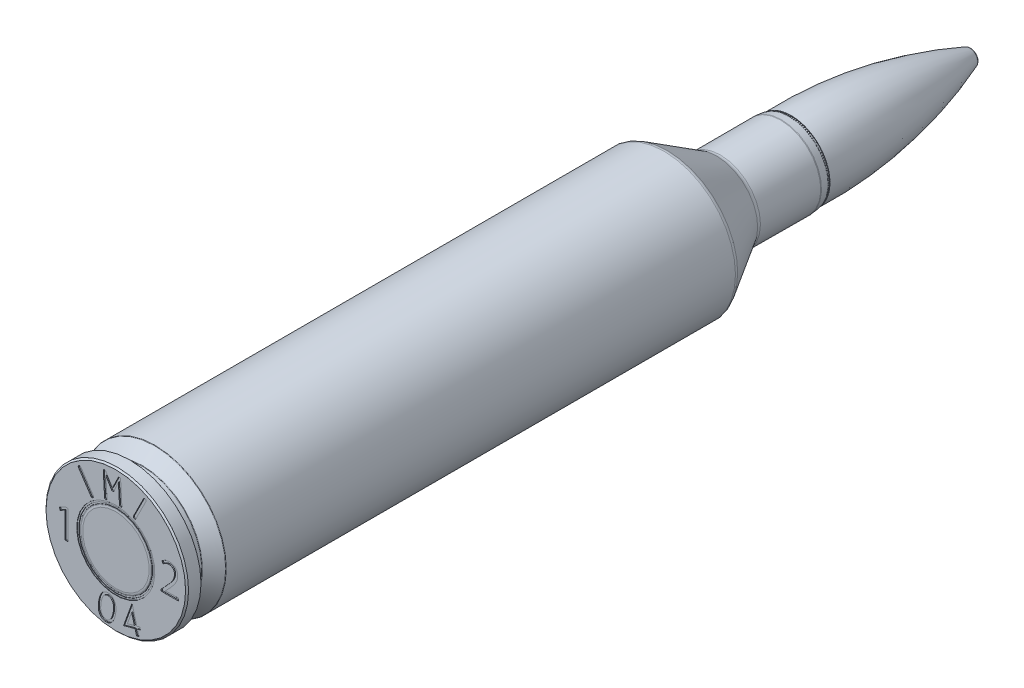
SolidWorks part; units mm, degrees
ref_plane "Front Plane" through (0, 0, 0) normal (0, 0, 1) x (1, 0, 0)
ref_plane "Top Plane" through (0, 0, 0) normal (0, 1, 0) x (1, 0, 0)
ref_plane "Right Plane" through (0, 0, 0) normal (1, 0, 0) x (0, 0, -1)
sketch "Sketch1" plane through (0, 0, 0) normal (1, 0, 0) x (0, 0, -1)
  line L0 (322.3442, 0) -> (-247.5758, 0) construction
  line L1 (-247.2877, 23.9259) -> (-247.4021, 23.4989)
  line L2 (-246.6517, 47.5) -> (-238.3732, 47.5)
  line L3 (-238.3632, 47.49) -> (-238.3632, 39.9859)
  line L4 (-247.65, 46.5059) -> (-246.6587, 47.4971)
  line L6 (322.3442, 0) -> (322.3442, 3.6277)
  line L7 (202.3442, 25.7903) -> (202.3442, 25.53)
  line L8 (202.3142, 25.5) -> (197.855, 25.5)
  line L9 (197.855, 25.5) -> (197.855, 26.0688)
  line L10 (156.693, 25.5) -> (156.693, 26.2616)
  line L11 (-243.7232, 0) -> (-243.7232, 35.1868)
  line L12 (155.1211, 26.737) -> (195.2929, 26.737)
  line L13 (-237.8632, 39.4859) -> (-229.8632, 39.4859)
  line L14 (-229.5093, 39.6326) -> (-221.8123, 47.3432)
  line L15 (-221.4584, 47.49) -> (117.7176, 47.49)
  line L16 (322.3442, 0) -> (-247.5758, 0)
  line L17 (119.9968, 46.7886) -> (152.5673, 27.4384)
  line L18 (-247.1911, 24) -> (-247.1758, 24)
  line L19 (-247.1558, 24.02) -> (-247.1558, 24.98)
  line L20 (-247.1758, 25) -> (-247.3829, 25)
  line L21 (-247.4029, 25.02) -> (-247.4029, 25.98)
  line L22 (-247.6329, 26) -> (-247.4229, 26)
  line L23 (-247.6529, 46.4988) -> (-247.6529, 26.02)
  line L24 (-247.5723, 0) -> (-247.5723, 22.2054)
  line L25 (-243.7232, 35.1868) -> (-229.8632, 35.1868)
  line L26 (-229.8632, 35.1868) -> (-218.06, 46.99)
  line L27 (-218.06, 46.99) -> (118.0215, 46.99)
  line L28 (118.0215, 46.99) -> (153.1241, 26.2616)
  line L29 (153.1241, 26.2616) -> (156.693, 26.2616)
  line L30 (156.693, 25.5) -> (156.693, 22.4101)
  line L31 (156.693, 22.4101) -> (159.0595, 7.5164)
  line L32 (159.0595, 7.5164) -> (159.0595, 0)
  line L33 (195.8453, 26.7064) -> (200.78, 26.1578)
  line L34 (117.7176, 47.49) -> (117.7204, 47.49)
  line L35 (119.9968, 46.7886) -> (119.7583, 46.9303)
  line L36 (197.855, 26.0688) -> (200.7472, 25.8355)
  line L37 (200.8683, 26.0474) -> (200.8546, 25.9241)
  arc A0 (322.3442, 3.6277) -> (321.0598, 5.4953) centre (320.3442, 3.6277) ccw
  arc A1 (-221.8123, 47.3432) -> (-221.4584, 47.49) centre (-221.4584, 46.99) cw
  arc A2 (-229.8632, 39.4859) -> (-229.5093, 39.6326) centre (-229.8632, 39.9859) ccw
  arc A3 (-247.65, 46.5059) -> (-247.6529, 46.4988) centre (-247.6429, 46.4988) ccw
  arc A4 (-238.3632, 47.49) -> (-238.3732, 47.5) centre (-238.3732, 47.49) ccw
  arc A5 (200.8683, 26.0474) -> (200.78, 26.1578) centre (200.7689, 26.0584) ccw
  arc A6 (-246.6587, 47.4971) -> (-246.6517, 47.5) centre (-246.6517, 47.49) cw
  arc A7 (202.3442, 25.53) -> (202.3142, 25.5) centre (202.3142, 25.53) cw
  arc A8 (200.8546, 25.9241) -> (200.7472, 25.8355) centre (200.7552, 25.9352) cw
  arc A9 (202.3442, 25.7903) -> (202.3539, 25.8003) centre (202.3542, 25.7903) cw
  arc A10 (119.7583, 46.9303) -> (117.7204, 47.49) centre (117.7204, 43.5) ccw
  arc A12 (-238.3632, 39.9859) -> (-237.8632, 39.4859) centre (-237.8632, 39.9859) ccw
  arc A13 (-247.1758, 24) -> (-247.1558, 24.02) centre (-247.1758, 24.02) ccw
  arc A14 (-247.1558, 24.98) -> (-247.1758, 25) centre (-247.1758, 24.98) ccw
  arc A15 (-247.3829, 25) -> (-247.4029, 25.02) centre (-247.3829, 25.02) cw
  arc A16 (-247.4029, 25.98) -> (-247.4229, 26) centre (-247.4229, 25.98) ccw
  arc A17 (-247.6329, 26) -> (-247.6529, 26.02) centre (-247.6329, 26.02) cw
  arc A18 (-247.4021, 23.4989) -> (-247.5723, 22.2054) centre (-242.5723, 22.2054) ccw
  arc A19 (155.1211, 26.737) -> (152.5673, 27.4384) centre (155.1211, 31.737) cw
  arc A20 (-247.2877, 23.9259) -> (-247.1911, 24) centre (-247.1911, 23.9) cw
  arc A21 (195.2929, 26.737) -> (195.8453, 26.7064) centre (195.2929, 21.737) cw
  spline S0 degree 3 poles (321.0598, 5.4953) (300.2598, 13.4659) (261.2716, 23.8428) (221.0033, 26.3182) (202.3539, 25.8003) knots 0.011064 0.011064 0.011064 0.011064 0.548393 0.999922 0.999922 0.999922 0.999922
  point P2 (-247.6558, 47.5)
  point P4 (-238.3632, 47.5)
  dimension "D1" = 0.1
  dimension "D2" = 5
  dimension "D3" = 5
  dimension "D4" = 3.99
  dimension "D5" = 0.01
  dimension "D6" = 0.01
revolve "Revolve2" add sketch "Sketch1" angle 360 about L0
sketch "Sketch3" plane through (0, 0, 247.6529) normal (0, 0, 1) x (1, 0, 0)
  circle A1 centre (0, 0) radius 27.1667 construction
  circle A2 centre (0, 0) radius 45.129 construction
  text T0 "1" font "@Kozuka Gothic Pro R" height in points 65
  text T1 "2" font "@Kozuka Gothic Pro R" height in points 65
  text T2 "     I M I" font "SWIsop2" height in points 65
  text T3 "                               0 4" font "Century Gothic" height in points 65
sketch "Sketch11" plane through (0, 0, -202.3442) normal (0, 0, 1) x (1, 0, 0)
  line L1 (-0.1176, 25.4699) -> (0.1176, 25.4699)
  line L2 (-0.1176, 25.4699) -> (-0.1176, 25.76)
  line L3 (-0.0876, 25.79) -> (0.0876, 25.79)
  line L4 (0.1176, 25.4699) -> (0.1176, 25.76)
  line L5 (-0.1176, 25.4699) -> (0.1176, 25.79) construction
  line L6 (-0.1176, 25.79) -> (0.1176, 25.4699) construction
  circle A0 centre (0, 0) radius 25.7903 construction
  arc A1 (0.0876, 25.79) -> (0.1176, 25.76) centre (0.0876, 25.76) cw
  arc A2 (-0.1176, 25.76) -> (-0.0876, 25.79) centre (-0.0876, 25.76) cw
  point P0 (0, 25.63)
  dimension "D1" = 0.03
extrude "Boss-Extrude5" add sketch "Sketch11" along normal blind 1.5
pattern_circular "CirPattern2" count 120 over 360 about axis through (0, 0, 0) along (0, 0, 1) of "Boss-Extrude5", "Revolve2"
extrude "Cut-Extrude4" cut sketch "Sketch3" against normal blind 0.7
fillet "Fillet6" radius 0.01 225 edges at (-32.8445, -11.0234, 246.9529) (-31.8978, -11.0234, 247.3029) (-33.7911, -2.3686, 246.9529) (-33.7911, -11.0234, 247.3029) (-33.817, 6.2861, 246.9529) (-33.7911, 6.2861, 247.3029) (-35.4398, 5.3702, 246.9529) (-33.843, 6.2861, 247.3029) (-37.2963, 5.2539, 246.9529) (-37.0367, 4.4542, 247.3029) (-35.5567, 7.1164, 246.9529) (-37.5559, 6.0535, 247.3029) (-32.7276, 8.1794, 246.9529) (-33.5574, 8.1794, 247.3029) (-31.8978, -1.422, 246.9529) (-31.8978, 8.1794, 247.3029) (-32.8445, -11.0234, 247.6529) (-31.8978, -1.422, 247.6529) (-32.7276, 8.1794, 247.6529) (-35.5567, 7.1164, 247.6529) (-37.2963, 5.2539, 247.6529) (-35.4398, 5.3702, 247.6529) (-33.817, 6.2861, 247.6529) (-33.7911, -2.3686, 247.6529) (41.7283, -7.6486, 246.9529) (41.7283, -6.8307, 247.3029) (36.0008, -8.4665, 246.9529) (41.7283, -8.4665, 247.3029) (30.2734, -7.853, 246.9529) (30.2734, -8.4665, 247.3029) (31.22, -6.2495, 246.9529) (30.2734, -7.2396, 247.3029) (35.4122, 9.5632, 247.3029) (31.1558, 8.6981, 246.9529) (31.5197, 7.9382, 247.3029) (30.7919, 9.4581, 247.3029) (35.8292, 11.1973, 247.3029) (41.2572, 5.7843, 247.3029) (33.9474, -5.965, 246.9529) (34.7133, -5.1518, 247.3029) (33.1814, -6.8045, 246.9529) (33.1814, -6.7782, 247.3029) (37.4549, -6.8307, 246.9529) (33.1814, -6.8307, 247.3029) (41.7283, -7.6486, 247.6529) (37.4549, -6.8307, 247.6529) (33.1814, -6.8045, 247.6529) (33.9474, -5.965, 247.6529) (31.1558, 8.6981, 247.6529) (31.22, -6.2495, 247.6529) (30.2734, -7.853, 247.6529) (36.0008, -8.4665, 247.6529) (18.8139, 39.3815, 247.3029) (19.952, 39.2382, 247.3029) (16.7335, 31.5071, 246.9529) (20.2216, 38.449, 247.3029) (13.2453, 24.5651, 247.3029) (12.2737, 24.3544, 247.3029) (15.1451, 32.3014, 246.9529) (11.6674, 25.378, 247.3029) (18.7183, 39.3032, 246.9529) (18.6227, 39.2249, 247.3029) (18.7183, 39.3032, 247.6529) (15.1451, 32.3014, 247.6529) (16.7335, 31.5071, 247.6529) (1.7041, 42.9112, 247.3029) (2.4506, 43.2333, 247.3029) (3.6207, 34.9344, 246.9529) (3.1788, 42.7156, 247.3029) (4.0627, 27.1532, 247.3029) (3.4077, 26.5366, 247.3029) (2.1072, 33.6808, 246.9529) (2.4804, 27.0876, 247.3029) (0.2124, 36.858, 246.9529) (1.7341, 40.274, 247.3029) (-1.3092, 33.442, 247.3029) (-1.7896, 33.0305, 247.3029) (-4.6736, 36.5456, 246.9529) (-2.7326, 33.2922, 247.3029) (-6.2399, 33.1918, 246.9529) (-6.6147, 39.799, 247.3029) (-5.865, 26.5846, 247.3029) (-6.5205, 25.9715, 247.3029) (-7.8854, 34.251, 246.9529) (-7.4478, 26.5225, 247.3029) (-8.2744, 42.1094, 246.9529) (-8.3229, 41.9795, 247.3029) (-8.2258, 42.2393, 247.3029) (-7.4142, 42.672, 247.3029) (-4.4793, 38.6945, 246.9529) (-6.8228, 42.4116, 247.3029) (-0.2159, 38.9443, 246.9529) (-2.1359, 34.9774, 247.3029) (-0.2159, 38.9443, 247.6529) (-4.4793, 38.6945, 247.6529) (-8.2744, 42.1094, 247.6529) (-7.8854, 34.251, 247.6529) (-6.2399, 33.1918, 247.6529) (-4.6736, 36.5456, 247.6529) (0.2124, 36.858, 247.6529) (2.1072, 33.6808, 247.6529) (3.6207, 34.9344, 247.6529) (-25.0534, 35.7975, 247.3029) (-24.3318, 36.7567, 247.3029) (-19.1324, 30.155, 246.9529) (-23.4586, 36.6249, 247.3029) (-14.8062, 23.6851, 247.3029) (-15.1458, 22.7077, 247.3029) (-20.7071, 29.1014, 246.9529) (-16.397, 22.6573, 247.3029) (-25.0354, 35.6715, 246.9529) (-25.0173, 35.5456, 247.3029) (-25.0354, 35.6715, 247.6529) (-20.7071, 29.1014, 247.6529) (-19.1324, 30.155, 247.6529) (-7.2335, -44.503, 247.3029) (-4.4679, -27.2271, 247.3029) (-4.6619, -28.8022, 247.3029) (-2.9898, -40.6974, 247.3029) (-6.9393, -43.0249, 247.3029) (7.8973, -33.3499, 247.6529) (5.1751, -40.9044, 247.3029) (10.7833, -25.7503, 247.6529) (10.6194, -25.7954, 247.3029) (12.4704, -31.2748, 247.6529) (10.9472, -25.7051, 247.3029) (14.9602, -36.5803, 247.6529) (13.9937, -36.8445, 247.3029) (16.1373, -37.082, 247.6529) (15.9266, -36.3162, 247.3029) (15.3815, -38.112, 247.6529) (16.348, -37.8478, 247.3029) (14.9234, -40.2355, 247.6529) (14.4151, -38.3762, 247.3029) (14.6324, -42.3139, 247.6529) (15.4317, -42.0949, 247.3029) (13.3249, -40.6736, 247.6529) (13.8332, -42.533, 247.3029) (8.9958, -39.8593, 247.6529) (12.8166, -38.8142, 247.3029) (10.0426, -37.9264, 246.9529) (11.4839, -33.9518, 246.9529) (9.1313, -34.5956, 246.9529) (7.8973, -33.3499, 246.9529) (10.7833, -25.7503, 246.9529) (12.4704, -31.2748, 246.9529) (14.9602, -36.5803, 246.9529) (16.1373, -37.082, 246.9529) (15.3815, -38.112, 246.9529) (14.9234, -40.2355, 246.9529) (14.6324, -42.3139, 246.9529) (13.3249, -40.6736, 246.9529) (8.9958, -39.8593, 246.9529) (10.0426, -37.9264, 247.6529) (7.69, -38.5701, 247.3029) (9.1313, -34.5956, 247.6529) (10.5726, -30.621, 247.3029) (11.4839, -33.9518, 247.6529) (12.3952, -37.2826, 247.3029)
scale "Scale2" bodies to scale 114 scale about centroid uniform scaling yes scale factor 0.1
